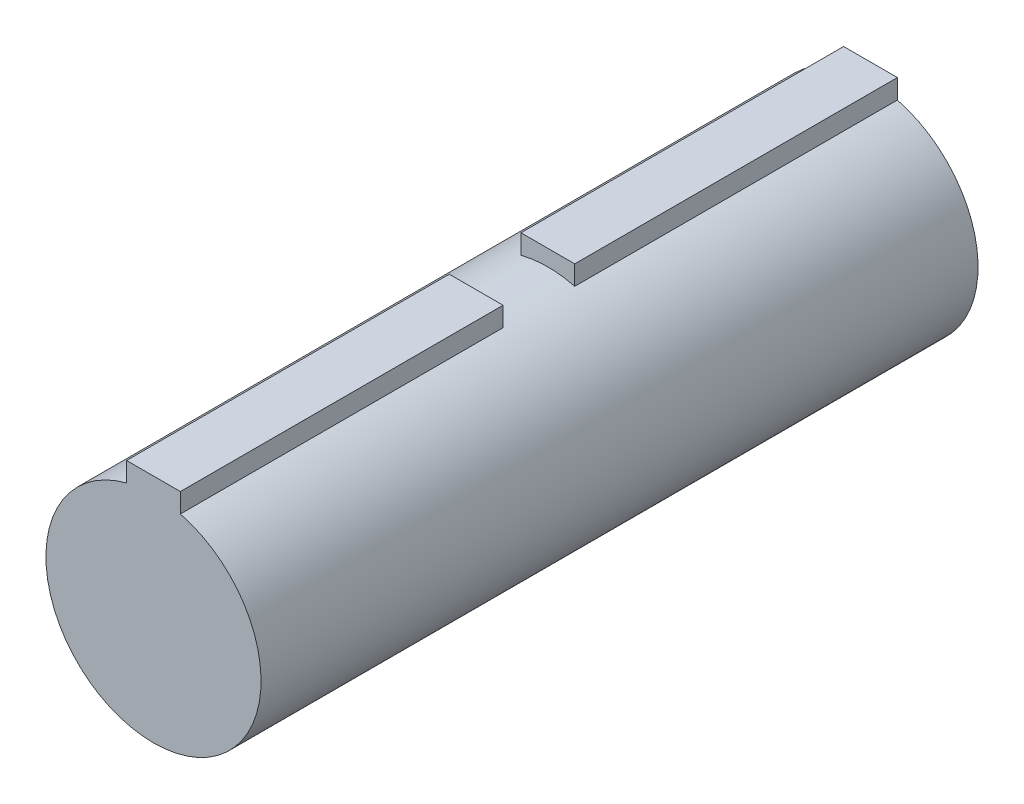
SolidWorks part; units mm, degrees
ref_plane "Front Plane" through (0, 0, 0) normal (0, 0, 1) x (1, 0, 0)
ref_plane "Top Plane" through (0, 0, 0) normal (0, 1, 0) x (1, 0, 0)
ref_plane "Right Plane" through (0, 0, 0) normal (1, 0, 0) x (0, 0, -1)
sketch "Sketch1" plane through (0, 0, 0) normal (0, 0, 1) x (1, 0, 0)
  line L6 (-2.3813, 10.9474) -> (2.3812, 10.9474)
  line L7 (-2.3813, 10.9474) -> (-2.3813, 9.2225)
  line L9 (2.3812, 10.9474) -> (2.3813, 9.2225)
  arc A0 (-2.3813, 9.2225) -> (2.3813, 9.2225) centre (0, 0) ccw
  dimension "D1" = 19.05
  dimension "D2" = 4.7625
  dimension "D3" = 1.7249
extrude "Boss-Extrude1" add sketch "Sketch1" along normal blind 28.575 contours A0 L9 L6 L7
sketch "Sketch2" plane through (0, 0, 28.575) normal (0, 0, 1) x (1, 0, 0)
  circle A0 centre (0, 0) radius 9.525
extrude "Boss-Extrude2" add sketch "Sketch2" along normal blind 6.35
sketch "Sketch3" plane through (0, 0, 34.925) normal (0, 0, 1) x (1, 0, 0)
  line L2 (-2.3812, 10.9474) -> (2.3813, 10.9474)
  line L3 (-2.3812, 10.9474) -> (-2.3812, 9.2225)
  line L5 (2.3813, 10.9474) -> (2.3813, 9.2225)
  arc A0 (-2.3812, 9.2225) -> (2.3813, 9.2225) centre (0, 0) ccw
  dimension "D3" = 9.525
  dimension "D1" = 4.7625
  dimension "D2" = 1.7249
extrude "Boss-Extrude3" add sketch "Sketch3" along normal blind 28.575 contours A0 L5 L2 L3
